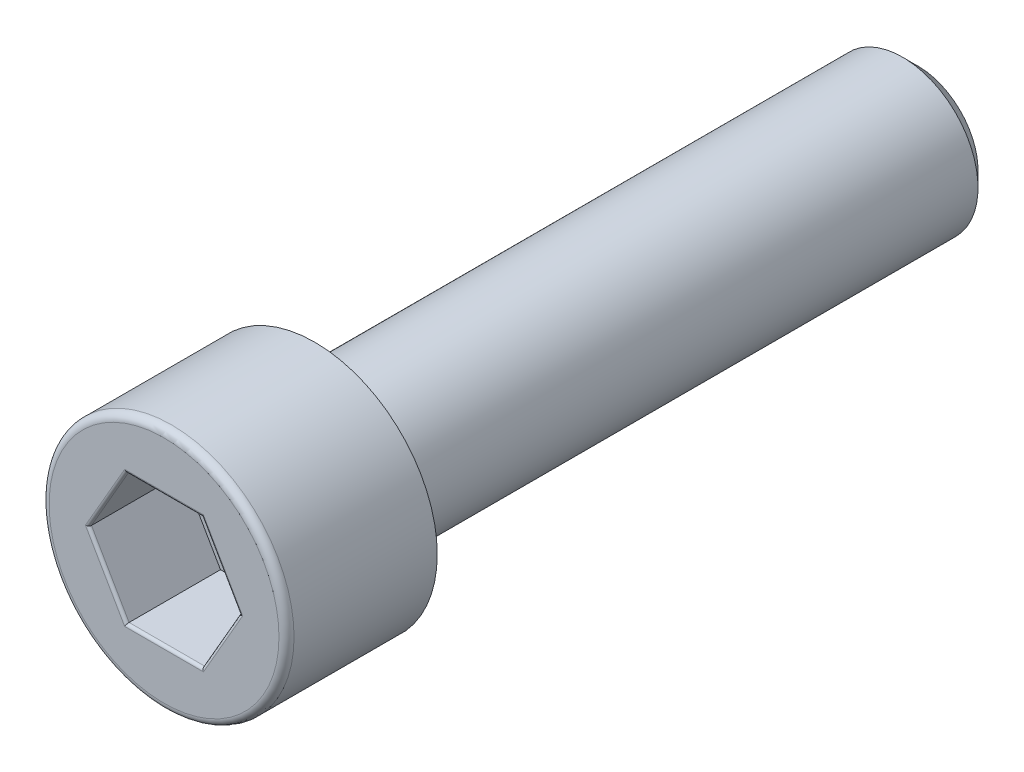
SolidWorks part; units mm, degrees
ref_plane "Plan1" through (0, 0, 0) normal (0, 0, 1) x (1, 0, 0)
ref_plane "Plan2" through (0, 0, 0) normal (0, 1, 0) x (1, 0, 0)
ref_plane "Plan3" through (0, 0, 0) normal (1, 0, 0) x (0, 0, -1)
sketch "Esquisse1" plane through (0, 0, 0) normal (0, 0, 1) x (1, 0, 0)
  circle A0 centre (0, 0) radius 6.5
extrude "Base-Extrusion" add sketch "Esquisse1" along normal blind 8
sketch "Esquisse2" plane through (0, 0, 8) normal (0, 0, 1) x (1, 0, 0)
  line L0 (-4, 0) -> (-2.0041, 3.4617)
  line L1 (-2.0041, 3.4617) -> (2.0041, 3.4617)
  line L2 (2.0041, 3.4617) -> (4, 0)
  line L3 (4, 0) -> (2.0041, -3.4617)
  line L4 (2.0041, -3.4617) -> (-2.0041, -3.4617)
  line L5 (-2.0041, -3.4617) -> (-4, 0)
extrude "Enlèv. mat.-Extru.1" cut sketch "Esquisse2" against normal blind 5
fillet "Congé1" radius 0.4
fillet "Congé2" radius 0.15
sketch "Esquisse3" plane through (0, 0, 0) normal (0, 0, -1) x (-1, 0, 0)
  circle A0 centre (0, 0) radius 4
  dimension "D1" = 8
extrude "Boss.-Extru.1" add sketch "Esquisse3" along normal blind 32
chamfer "Chanfrein1" distance 0.8 angle 45
